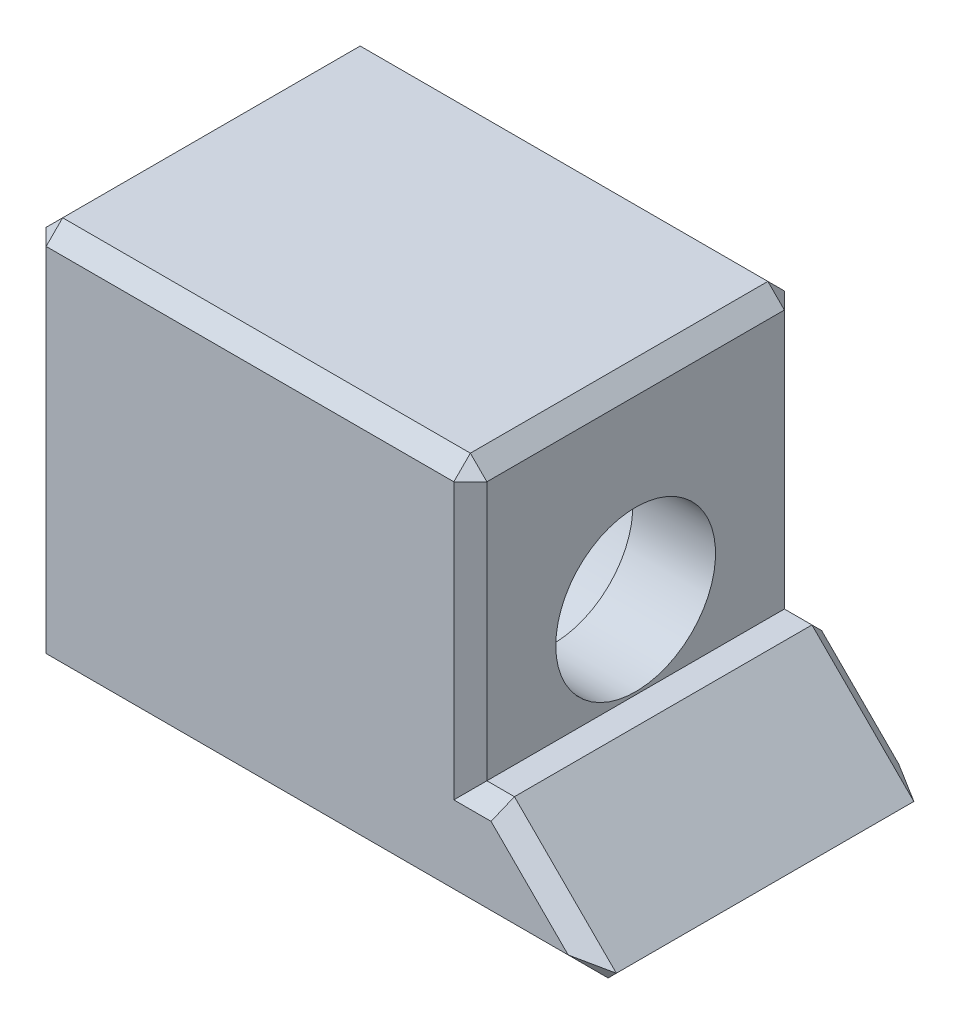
SolidWorks part; units mm, degrees
ref_plane "前视基准面" through (0, 0, 0) normal (0, 0, 1) x (1, 0, 0)
ref_plane "上视基准面" through (0, 0, 0) normal (0, 1, 0) x (1, 0, 0)
ref_plane "右视基准面" through (0, 0, 0) normal (1, 0, 0) x (0, 0, -1)
other "Configuration Table"
sketch "草图1" plane through (0, 0, 0) normal (0, 0, 1) x (1, 0, 0)
  line L0 (8, 0) -> (10.5, 0)
  line L5 (0, 0) -> (8, 0)
  line L6 (0, 0) -> (0, 7)
  line L7 (0, 7) -> (8, 7)
  line L8 (8, 0) -> (8, 7)
  line L9 (10.5, 0) -> (8.5, 2)
  line L10 (8.5, 2) -> (8, 2)
  dimension "D1" = 45
  dimension "D2" = 2.5
  dimension "D3" = 8
  dimension "D4" = 7
  dimension "D5" = 2
extrude "凸台-拉伸1" add sketch "草图1" along normal blind 6 contours L9 L10 L8 L0 | L5 L8 L7 L6
hole_wizard "M2.5 六角圆柱头螺钉的柱形沉头孔1" positions "草图3" profile "草图2" counterbore size "M2.5" standard "GB"
sketch "草图3" plane through (0, 0, 0) normal (-1, 0, 0) x (0, 0, 1)
  line L0 (3, 7) -> (3, 0) construction
  line L1 (6, 7) -> (0, 7) construction
  line L2 (6, 0) -> (0, 0) construction
  point P0 (3, 3.5)
sketch "草图2" plane through (0, 3.5, 3) normal (0, 1, 0) x (0, 0, 1)
  line L0 (0, 0) -> (0, 10.5)
  line L1 (0, 10.5) -> (1.45, 10.5)
  line L3 (1.45, 10.5) -> (1.45, 6.5)
  line L4 (1.45, 6.5) -> (2.5, 6.5)
  line L5 (2.5, 6.5) -> (2.5, 0)
  line L7 (2.5, 0) -> (0, 0)
  line L11 (0, -6.35) -> (0, 107.95) construction
  dimension "通孔孔直径" = 2.9
  dimension "通孔孔深度" = 10.5
  dimension "柱形沉头孔直径" = 5
  dimension "柱形沉头孔深度" = 6.5
chamfer "倒角1" distance 0.3 angle 45 16 edges at (10.5, 0, 3) (8, 7, 3) (0, 7, 3) (8.25, 2, 0) (8, 4.5, 0) (4, 7, 0) (0, 3.5, 0) (9.5, 1, 0) (0, 3.5, 6) (4, 7, 6) (8, 4.5, 6) (8.25, 2, 6) (9.5, 1, 6) (5.25, 0, 6) (0, 0, 3) (5.25, 0, 0)
